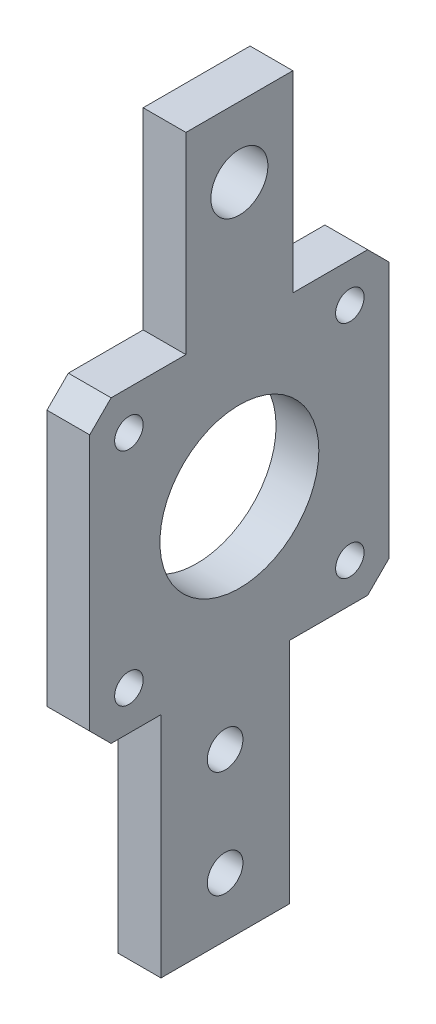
SolidWorks part; units mm, degrees
ref_plane "Alzado" through (0, 0, 0) normal (0, 0, 1) x (1, 0, 0)
ref_plane "Planta" through (0, 0, 0) normal (0, 1, 0) x (1, 0, 0)
ref_plane "Vista lateral" through (0, 0, 0) normal (1, 0, 0) x (0, 0, -1)
other "Graphic1"
other "Graphic (Closed) -1"
imported_body "Imported1"
other "Convert Mesh to Standard1"
sketch "Sketch2" plane through (6, 0, 0) normal (1, 0, 0) x (0, 0, -1)
  line L0 (-18, 21) -> (-21, 18)
  line L1 (-21, 18) -> (-21, -18)
  line L2 (-21, -18) -> (-18, -21)
  line L3 (-18, -21) -> (-11, -21)
  line L4 (7, -21) -> (18, -21)
  line L5 (18, -21) -> (21, -18)
  line L6 (21, -18) -> (21, 18)
  line L7 (21, 18) -> (18, 21)
  line L8 (18, 21) -> (7.5, 21)
  line L12 (-7.5, 21) -> (-18, 21)
  line L13 (-7.5, 21) -> (-7.5, 48)
  line L14 (-7.5, 48) -> (7.5, 48)
  line L15 (7.5, 48) -> (7.5, 21)
  line L16 (-11, -21) -> (-11, -53)
  line L17 (-11, -53) -> (7, -53)
  line L18 (7, -53) -> (7, -21)
  dimension "D1" = 48
extrude "Boss-Extrude1" add sketch "Sketch2" against normal up to surface (6 mm away)
sketch "Sketch3" plane through (6, 0, 0) normal (1, 0, 0) x (0, 0, -1)
  line L0 (21, 18) -> (21, -18) construction
  line L1 (18, 21) -> (7.5, 21) construction
  line L2 (0, 6.9373) -> (0, -8.075) construction
  circle A0 centre (15.5, 15.5) radius 2
  circle A1 centre (15.5, -15.5) radius 2
  circle A2 centre (-15.5, -15.5) radius 2
  circle A3 centre (-15.5, 15.5) radius 2
  circle A4 centre (0, 0) radius 11.15
  circle A5 centre (0, 38.2) radius 4
  point P17 (0, 0)
  point P20 (0, 0)
extrude "Cut-Extrude1" cut sketch "Sketch3" against normal blind 10
sketch "Sketch4" plane through (6, 0, 0) normal (1, 0, 0) x (0, 0, -1)
  line L3 (-4.2289, 34.5621) -> (4.2289, 34.5621)
  line L4 (-4.2289, 34.5621) -> (-4.2289, 25.4379)
  line L5 (-4.2289, 25.4379) -> (4.2289, 25.4379)
  line L6 (4.2289, 34.5621) -> (4.2289, 25.4379)
  line L7 (-4.2289, 34.5621) -> (4.2289, 25.4379) construction
  line L8 (-4.2289, 25.4379) -> (4.2289, 34.5621) construction
  circle A0 centre (0, 30) radius 2.5
  dimension "D1" = 5
extrude "Boss-Extrude2" add sketch "Sketch4" against normal up to surface (6 mm away)
sketch "Sketch5" plane through (6, 0, 0) normal (1, 0, 0) x (0, 0, -1)
  line L0 (-11, -53) -> (7, -53) construction
  line L2 (-2, -47.23) -> (4.8642, -47.23) construction
  circle A0 centre (-2, -29.73) radius 2.5
  circle A1 centre (-2, -44.73) radius 2.5
  circle A2 centre (0, 38.2) radius 4
  arc A3 (1.6629, 34.5621) -> (-1.6629, 34.5621) centre (0, 38.2) ccw construction
  point P6 (-2, -53)
  dimension "D1" = 5
  dimension "D2" = 5
  dimension "D3" = 15
  dimension "D4" = 5.77
extrude "Cut-Extrude2" cut sketch "Sketch5" against normal blind 10
equation "\"distancia\"=5.5"
equation "\"D5@Sketch3\"=\"distancia\""
equation "\"m\"=4"
equation "\"D2@Sketch3\"=\"m\""
